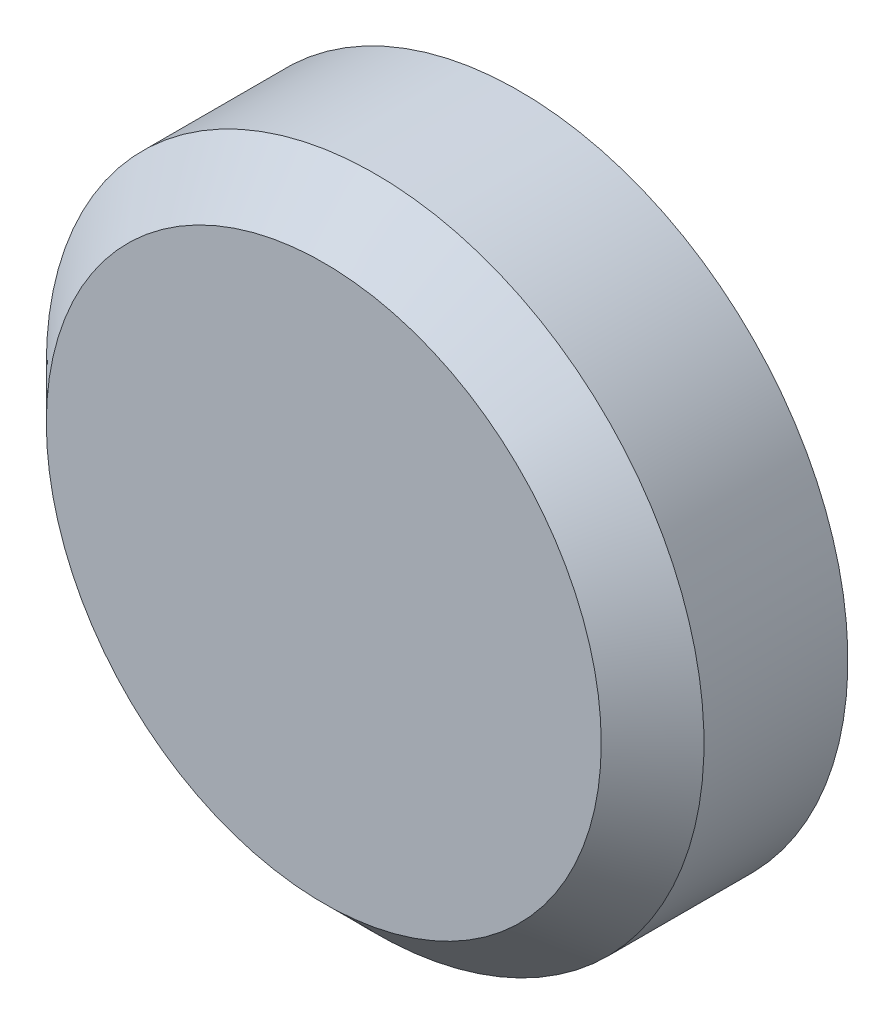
SolidWorks part; units mm, degrees
ref_plane "Plan1" through (0, 0, 0) normal (0, 0, 1) x (1, 0, 0)
ref_plane "Plan2" through (0, 0, 0) normal (0, 1, 0) x (1, 0, 0)
ref_plane "Plan3" through (0, 0, 0) normal (1, 0, 0) x (0, 0, -1)
sketch "Esquisse1" plane through (0, 0, 0) normal (0, 0, 1) x (1, 0, 0)
  circle A0 centre (0, 0) radius 3.2
extrude "Base-Extrusion" add sketch "Esquisse1" along normal blind 1.9
chamfer "Chanfrein1" distance 0.5 angle 45
